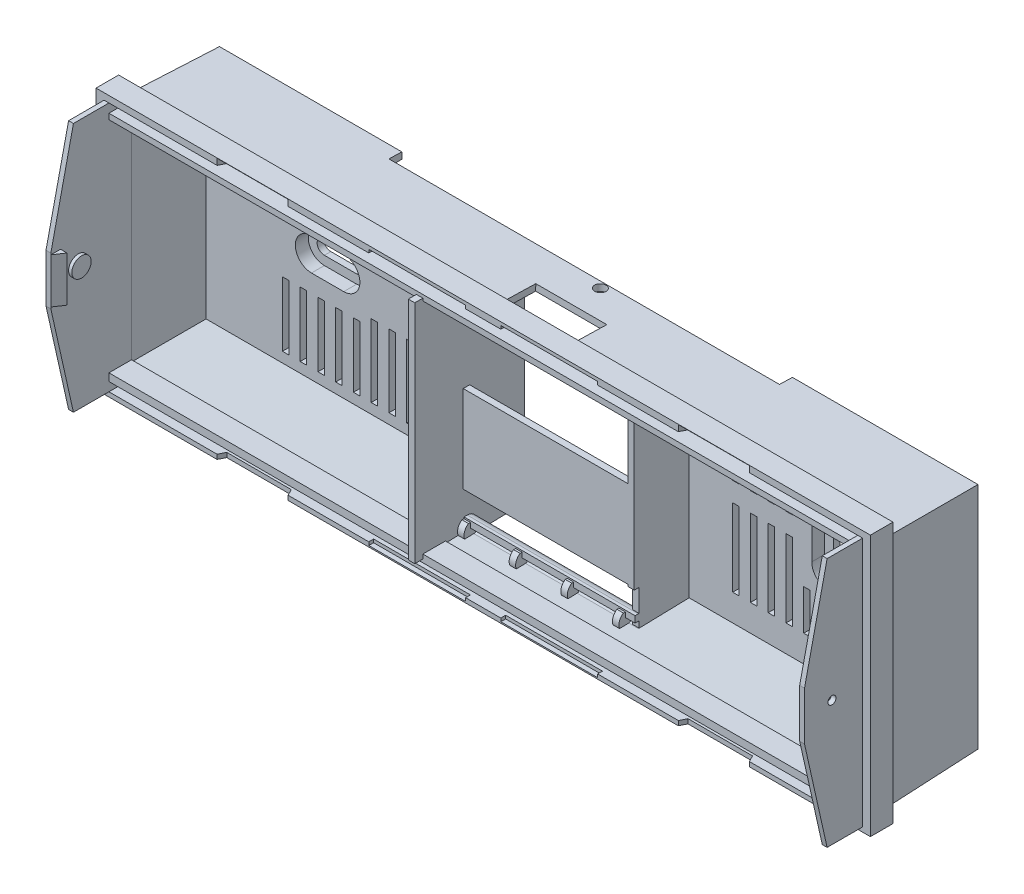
SolidWorks part; units mm, degrees
ref_plane "Plan1" through (0, 0, 0) normal (0, 0, 1) x (1, 0, 0)
ref_plane "Plan2" through (0, 0, 0) normal (0, 1, 0) x (1, 0, 0)
ref_plane "Plan3" through (0, 0, 0) normal (1, 0, 0) x (0, 0, -1)
sketch "Esquisse1" plane through (0, 0, 0) normal (0, 0, 1) x (1, 0, 0)
  line L1 (-124, 35.5) -> (111, 35.5)
  line L2 (-124, 35.5) -> (-124, -35.5)
  line L3 (-124, -35.5) -> (111, -35.5)
  line L4 (111, 35.5) -> (111, -35.5)
  dimension "D1" = 235
  dimension "D2" = 71
  dimension "D3" = 35.5
  dimension "D4" = 111
extrude "Extrusion1" add sketch "Esquisse1" along normal blind 1.5
sketch "Esquisse2" plane through (0, 0, 0) normal (0, 0, -1) x (-1, 0, 0)
  line L1 (-111, 35.5) -> (124, 35.5)
  line L2 (-111, 35.5) -> (-111, -35.5)
  line L3 (-111, -35.5) -> (124, -35.5)
  line L4 (124, 35.5) -> (124, -35.5)
extrude "Extrusion2" add sketch "Esquisse2" against normal blind 28.5 draft 1.5 from offset 4 contours L2 L3 L4 L1
sketch "Esquisse3" plane through (0, 0, 24.5) normal (0, 0, 1) x (1, 0, 0)
  line L0 (111.7463, 36.2463) -> (-124.7463, 36.2463) construction
  line L1 (-122.7463, 34.2463) -> (109.7463, 34.2463)
  line L2 (-122.7463, 34.2463) -> (-122.7463, -34.2463)
  line L3 (-122.7463, -34.2463) -> (109.7463, -34.2463)
  line L4 (109.7463, 34.2463) -> (109.7463, -34.2463)
  line L5 (-124.7463, 36.2463) -> (-124.7463, -36.2463) construction
  line L6 (111.7463, -36.2463) -> (-124.7463, -36.2463) construction
  line L7 (111.7463, 36.2463) -> (111.7463, -36.2463) construction
  dimension "D1" = 2
  dimension "D2" = 2
  dimension "D3" = 2
  dimension "D4" = 2
extrude "Enlèv. mat.-Extru.1" cut sketch "Esquisse3" against normal blind 22.5 draft 1.5
sketch "Esquisse4" plane through (0, 0, -4) normal (0, 0, -1) x (-1, 0, 0)
  line L0 (-111, 35.5) -> (124, 35.5) construction
  line L1 (-109, 33.5) -> (122, 33.5)
  line L2 (-109, 33.5) -> (-109, -33.5)
  line L3 (-109, -33.5) -> (122, -33.5)
  line L4 (122, 33.5) -> (122, -33.5)
  line L5 (-111, 35.5) -> (-111, -35.5) construction
  line L6 (-111, -35.5) -> (124, -35.5) construction
  line L7 (124, 35.5) -> (124, -35.5) construction
  dimension "D1" = 2
  dimension "D2" = 2
  dimension "D3" = 2
  dimension "D4" = 2
extrude "Enlèv. mat.-Extru.2" cut sketch "Esquisse4" against normal blind 4
sketch "Esquisse5" plane through (0, 0, 0) normal (0, 1, 0) x (1, 0, 0)
  line L1 (111, 4) -> (-124, 4) construction
  line L2 (-67.5, 4) -> (53.5, 4)
  line L3 (-67.5, 4) -> (-67.5, 0)
  line L4 (-67.5, 0) -> (53.5, 0)
  line L5 (53.5, 4) -> (53.5, 0)
  dimension "D1" = 4
  dimension "D2" = 121
  dimension "D3" = 67.5
extrude "Enlèv. mat.-Extru.3" cut sketch "Esquisse5" against normal mid plane 80
sketch "Esquisse6" plane through (0, 0, 0) normal (0, 0, -1) x (-1, 0, 0)
  line L0 (-111.7463, -36.2463) -> (124.7463, -36.2463) construction
  line L1 (-25.5, 33.6047) -> (25.5, 33.6047)
  line L2 (-25.5, 33.6047) -> (-25.5, -36.2463)
  line L3 (-25.5, -36.2463) -> (25.5, -36.2463)
  line L4 (25.5, 33.6047) -> (25.5, -36.2463)
  line L5 (-53.5, 35.6047) -> (67.5, 35.6047) construction
  dimension "D1" = 51
  dimension "D2" = 25.5
  dimension "D3" = 2
extrude "Enlèv. mat.-Extru.4" cut sketch "Esquisse6" against normal blind 17
sketch "Esquisse7" plane through (0, 35.5803, -0.9317) normal (0, 0.9997, -0.0262) x (-1, 0, 0)
  line L0 (-53.5, 0.932) -> (67.5, 0.932) construction
  line L2 (-11, 11.932) -> (11, 11.932)
  line L3 (-11, 11.932) -> (-11, 22.432)
  line L4 (-11, 22.432) -> (11, 22.432)
  line L5 (11, 11.932) -> (11, 22.432)
  circle A0 centre (0, 2.932) radius 1.75
  dimension "D1" = 3.5
  dimension "D2" = 2
  dimension "D3" = 10.5
  dimension "D4" = 22
  dimension "D5" = 11
  dimension "D6" = 11
extrude "Enlèv. mat.-Extru.5" cut sketch "Esquisse7" against normal blind 10
sketch "Esquisse8" plane through (0, 0, 0) normal (0, 0, -1) x (-1, 0, 0)
  line L0 (-25.5, 33.6047) -> (-25.5, -35.6047) construction
  line L1 (-111, 35.5) -> (-53.5, 35.5) construction
  line L2 (-78.5, 5) -> (-78.5, -5)
  line L3 (67.5, 35.5) -> (124, 35.5) construction
  line L4 (-62.5, 5) -> (-62.5, -5)
  line L5 (79.5, 8) -> (89.5, 8)
  line L6 (25.5, -35.6047) -> (25.5, 33.6047) construction
  line L7 (79.5, -8) -> (89.5, -8)
  arc A0 (-78.5, 5) -> (-62.5, 5) centre (-70.5, 5) cw
  arc A1 (-62.5, -5) -> (-78.5, -5) centre (-70.5, -5) cw
  arc A2 (79.5, 8) -> (79.5, -8) centre (79.5, 0) ccw
  arc A3 (89.5, 8) -> (89.5, -8) centre (89.5, 0) cw
  dimension "D7" = 8
  dimension "D8" = 8
  dimension "D1" = 16
  dimension "D2" = 10
  dimension "D3" = 10
  dimension "D4" = 10
  dimension "D5" = 53
  dimension "D6" = 30.5
  dimension "D9" = 10
  dimension "D10" = 10
  dimension "D11" = 10
  dimension "D12" = 16
  dimension "D13" = 35.5
  dimension "D14" = 64
extrude "Extrusion3" add sketch "Esquisse8" along normal blind 4
sketch "Esquisse9" plane through (81.6987, 0.3521, -4) normal (0, 0, -1) x (-1, 0, 0)
  line L2 (161.1987, 4.6479) -> (171.1987, 4.6479)
  line L4 (161.1987, -5.3521) -> (171.1987, -5.3521)
  line L8 (6.1987, 4.6479) -> (6.1987, -5.3521)
  line L9 (16.1987, 4.6479) -> (16.1987, -5.3521)
  arc A0 (19.1987, 4.6479) -> (3.1987, 4.6479) centre (11.1987, 4.6479) ccw construction
  arc A1 (3.1987, -5.3521) -> (19.1987, -5.3521) centre (11.1987, -5.3521) ccw construction
  arc A2 (171.1987, -8.3521) -> (171.1987, 7.6479) centre (171.1987, -0.3521) ccw construction
  arc A3 (161.1987, 7.6479) -> (161.1987, -8.3521) centre (161.1987, -0.3521) ccw construction
  arc A6 (16.1987, -5.3521) -> (6.1987, -5.3521) centre (11.1987, -5.3521) cw
  arc A7 (6.1987, 4.6479) -> (16.1987, 4.6479) centre (11.1987, 4.6479) cw
  arc A8 (171.1987, 4.6479) -> (171.1987, -5.3521) centre (171.1987, -0.3521) cw
  arc A9 (161.1987, 4.6479) -> (161.1987, -5.3521) centre (161.1987, -0.3521) ccw
  dimension "D7" = 10
  dimension "D8" = 5
  dimension "D2" = 5
  dimension "D5" = 5
  dimension "D1" = 5
  dimension "D3" = 10
  dimension "D4" = 10
  dimension "D6" = 10
  dimension "D9" = 10
  dimension "D10" = 10
extrude "Enlèv. mat.-Extru.6" cut sketch "Esquisse9" against normal blind 10 from offset 2
sketch "Esquisse10" plane through (0, 0, -4) normal (0, 0, -1) x (-1, 0, 0)
  line L2 (-72.75, 5) -> (-72.75, -5)
  line L3 (79.5, 2.25) -> (89.5, 2.25)
  line L4 (-68.25, 5) -> (-68.25, -5)
  line L6 (79.5, -2.25) -> (89.5, -2.25)
  arc A0 (-72.75, 5) -> (-68.25, 5) centre (-70.5, 5) cw
  arc A1 (-68.25, -5) -> (-72.75, -5) centre (-70.5, -5) cw
  arc A2 (-62.5, 5) -> (-78.5, 5) centre (-70.5, 5) ccw construction
  arc A3 (-78.5, -5) -> (-62.5, -5) centre (-70.5, -5) ccw construction
  arc A4 (79.5, 2.25) -> (79.5, -2.25) centre (79.5, 0) ccw
  arc A5 (89.5, 2.25) -> (89.5, -2.25) centre (89.5, 0) cw
  arc A6 (89.5, -8) -> (89.5, 8) centre (89.5, 0) ccw construction
  arc A7 (79.5, 8) -> (79.5, -8) centre (79.5, 0) ccw construction
  dimension "D2" = 2.25
  dimension "D3" = 4.5
  dimension "D5" = 10
  dimension "D1" = 4.5
  dimension "D4" = 10
  dimension "D6" = 10
extrude "Enlèv. mat.-Extru.7" cut sketch "Esquisse10" against normal blind 10
sketch "Esquisse11" plane through (0, 0, 2) normal (0, 0, 1) x (1, 0, 0)
  line L1 (25.5, 35) -> (27.5, 35)
  line L2 (25.5, 35) -> (25.5, -35)
  line L3 (25.5, -35) -> (27.5, -35)
  line L4 (27.5, 35) -> (27.5, -35)
  dimension "D1" = 2
  dimension "D2" = 70
  dimension "D3" = 35
  dimension "D4" = 25.5
extrude "Extrusion4" add sketch "Esquisse11" along normal blind 17
sketch "Esquisse12" plane through (0, 0, 2) normal (0, 0, 1) x (1, 0, 0)
  line L1 (-25.5, 35) -> (-27.5, 35)
  line L2 (-25.5, 35) -> (-25.5, -35)
  line L3 (-25.5, -35) -> (-27.5, -35)
  line L4 (-27.5, 35) -> (-27.5, -35)
  dimension "D1" = 2
  dimension "D2" = 70
  dimension "D3" = 35
  dimension "D4" = 25.5
extrude "Extrusion5" add sketch "Esquisse12" along normal blind 32
sketch "Esquisse13" plane through (25.5, 0, 0) normal (-1, 0, 0) x (0, 0, 1)
  line L1 (19, 4.5) -> (17, 4.5)
  line L2 (19, 4.5) -> (19, -22.5)
  line L3 (19, -22.5) -> (17, -22.5)
  line L4 (17, 4.5) -> (17, -22.5)
  line L6 (0, 0) -> (23.4559, 0) construction
  line L7 (19, 34.1023) -> (19, -34.1023) construction
  dimension "D1" = 2
  dimension "D2" = 27
  dimension "D3" = 4.5
extrude "Extrusion6" add sketch "Esquisse13" along normal up to next
sketch "Esquisse15" plane through (27.5, 0, 0) normal (1, 0, 0) x (0, 0, -1)
  line L0 (-19, -34.1023) -> (-19, 34.1023) construction
  line L1 (-17.5, -34.063) -> (-19, -34.1023)
  line L2 (-19, -34.1023) -> (-19, -23.1023)
  line L3 (-19, -23.1023) -> (-17.5, -23.1023)
  line L4 (-17.5, -34.063) -> (-17.5, -23.1023)
  line L7 (-19, -34.1023) -> (-2, -33.6571) construction
  point P11 (-13.9712, -36.3603)
  dimension "D1" = 11
  dimension "D2" = 1.5
extrude "Enlèv. mat.-Extru.8" cut sketch "Esquisse15" against normal blind 10
sketch "Esquisse14" plane through (-25.5, 0, 0) normal (1, 0, 0) x (0, 0, -1)
  line L0 (-24.5, -36.2463) -> (4, -35.5) construction
  line L1 (0, -35.6047) -> (0, 33.6047) construction
  line L2 (-17.75, -34.0695) -> (-17.75, -36.0695)
  line L3 (-17.75, -32.0695) -> (-18.75, -32.0695)
  line L4 (-18.75, -32.0695) -> (-18.75, -30.0695)
  line L5 (-18.75, -30.0695) -> (-17.75, -30.0695)
  arc A0 (-17.75, -36.0695) -> (-17.75, -30.0695) centre (-17.75, -33.0695) ccw
  arc A1 (-17.75, -34.0695) -> (-17.75, -32.0695) centre (-17.75, -33.0695) ccw
  dimension "D1" = 3
  dimension "D2" = 17.75
  dimension "D4" = 1
  dimension "D3" = 2
extrude "Extrusion7" add sketch "Esquisse14" along normal up to surface (53 mm away)
sketch "Esquisse16" plane through (-25.5, 0, 0) normal (1, 0, 0) x (0, 0, -1)
  line L0 (-20.3644, -34.5409) -> (-16.3644, -34.5409)
  line L1 (-16.3644, -34.5409) -> (-16.3644, -30.5409)
  line L2 (-16.3644, -30.5409) -> (-19.3644, -30.5409)
  arc A0 (-17.6977, -34.0682) -> (-17.75, -32.0695) centre (-17.75, -33.0695) ccw construction
  arc A2 (-19.3644, -30.5409) -> (-20.3644, -34.5409) centre (-17.75, -33.0695) ccw
  point P1 (-18.6119, -29.1773)
  point P7 (-19.9491, -35.2924)
  dimension "D1" = 3
  dimension "D2" = 4
  dimension "D3" = 4
  dimension "D4" = 1
extrude "Extrusion8" add sketch "Esquisse16" along normal blind 2
pattern_linear "Répétition linéaire1" count 4 spacing 16 along (1, 0, 0) of "Extrusion8"
sketch "Esquisse17" plane through (0, 0, 24.5) normal (0, 0, 1) x (1, 0, 0)
  line L1 (-122.7463, 34.2463) -> (109.1571, 34.2463)
  line L2 (-122.7463, 34.2463) -> (-122.7463, -33.6571)
  line L3 (-122.7463, -33.6571) -> (109.1571, -33.6571)
  line L4 (109.1571, 34.2463) -> (109.1571, -33.6571)
  line L5 (-126.7463, 40.7463) -> (113.1571, 40.7463)
  line L6 (-126.7463, 40.7463) -> (-126.7463, -40.1571)
  line L7 (-126.7463, -40.1571) -> (113.1571, -40.1571)
  line L8 (113.1571, 40.7463) -> (113.1571, -40.1571)
  dimension "D1" = 6.5
  dimension "D2" = 6.5
  dimension "D3" = 4
  dimension "D4" = 4
extrude "Extrusion9" add sketch "Esquisse17" along normal blind 7
sketch "Esquisse18" plane through (0, 0, 31.5) normal (0, 0, 1) x (1, 0, 0)
  line L0 (-122.7463, 34.2463) -> (-122.7463, -33.6571) construction
  line L1 (-122.7463, 35.9963) -> (109.1571, 35.9963)
  line L2 (-122.7463, 35.9963) -> (-122.7463, 38.7463)
  line L3 (-122.7463, 38.7463) -> (109.1571, 38.7463)
  line L4 (109.1571, 35.9963) -> (109.1571, 38.7463)
  line L5 (109.1571, -33.6571) -> (109.1571, 34.2463) construction
  line L6 (113.1571, 40.7463) -> (-126.7463, 40.7463) construction
  line L7 (0, 0) -> (-126.1043, 0) construction
  line L8 (109.1571, -35.9963) -> (109.1571, -38.7463)
  line L9 (-122.7463, -38.7463) -> (109.1571, -38.7463)
  line L10 (-122.7463, -35.9963) -> (-122.7463, -38.7463)
  line L11 (-122.7463, -35.9963) -> (109.1571, -35.9963)
  dimension "D1" = 2.75
  dimension "D2" = 2
extrude "Enlèv. mat.-Extru.9" cut sketch "Esquisse18" against normal blind 5
sketch "Esquisse19" plane through (0, -40.1571, 0) normal (0, -1, 0) x (1, 0, 0)
  line L0 (-126.7463, 31.5) -> (113.1571, 31.5) construction
  line L1 (-67.2463, 31.5) -> (-89.2463, 31.5)
  line L2 (-68.2463, 29.5) -> (-67.2463, 31.5)
  line L3 (-68.2463, 29.5) -> (-88.2463, 29.5)
  line L4 (-88.2463, 29.5) -> (-89.2463, 31.5)
  line L5 (113.1571, 31.5) -> (113.1571, 24.5) construction
  line L6 (74.6571, 29.5) -> (75.6571, 31.5)
  line L7 (54.6571, 29.5) -> (74.6571, 29.5)
  line L8 (54.6571, 29.5) -> (53.6571, 31.5)
  line L9 (53.6571, 31.5) -> (75.6571, 31.5)
  line L10 (-126.7463, 31.5) -> (-126.7463, 24.5) construction
  point P6 (113.1571, 28)
  point P13 (-126.7463, 28)
  dimension "D1" = 2
  dimension "D2" = 20
  dimension "D3" = 22
  dimension "D4" = 1
  dimension "D5" = 38.5
  dimension "D6" = 22
  dimension "D7" = 20
  dimension "D9" = 1
  dimension "D10" = 2
  dimension "D11" = 38.5
extrude "Enlèv. mat.-Extru.10" cut sketch "Esquisse19" against normal blind 2.5 and the other way blind 0.5
sketch "Esquisse20" plane through (0, 0, 31.5) normal (0, 0, 1) x (1, 0, 0)
  line L0 (-67.2463, -38.7463) -> (53.6571, -38.7463) construction
  line L1 (-42.2463, -38.7463) -> (-12.2463, -38.7463)
  line L2 (-42.2463, -38.7463) -> (-42.2463, -39.7463)
  line L3 (-42.2463, -39.7463) -> (-12.2463, -39.7463)
  line L4 (-12.2463, -38.7463) -> (-12.2463, -39.7463)
  line L5 (-67.2463, -38.7463) -> (-67.2463, -40.1571) construction
  line L6 (28.6571, -38.7463) -> (-1.3429, -38.7463)
  line L7 (28.6571, -38.7463) -> (28.6571, -39.7463)
  line L8 (28.6571, -39.7463) -> (-1.3429, -39.7463)
  line L9 (-1.3429, -38.7463) -> (-1.3429, -39.7463)
  point P10 (-67.2463, -39.4517)
  dimension "D1" = 1
  dimension "D2" = 30
  dimension "D3" = 25
  dimension "D4" = 1
  dimension "D5" = 30
  dimension "D6" = 25
extrude "Enlèv. mat.-Extru.11" cut sketch "Esquisse20" against normal blind 1.5
mirror "Symétrie1" about plane through (0, 0, 0) normal (0, 1, 0) of "Enlèv. mat.-Extru.10", "Enlèv. mat.-Extru.11"
sketch "Esquisse22" plane through (-122.7463, 0, 0) normal (1, 0, 0) x (0, 0, -1)
  line L0 (-31.5, -38.7463) -> (-42.5, -38.7463)
  line L1 (-42.5, -38.7463) -> (-49.5, -7.5013)
  line L2 (-49.5, -7.5013) -> (-49.5, 7.4987)
  line L3 (-49.5, 7.4987) -> (-42.5, 38.7463)
  line L4 (-42.5, 38.7463) -> (-31.5, 38.7463)
  line L6 (-31.5, 38.7463) -> (-31.5, -38.7463)
  line L10 (-26.5, -38.7463) -> (-31.5, -38.7463) construction
  line L11 (-26.5, 38.7463) -> (-31.5, 38.7463) construction
  dimension "D1" = 11
  dimension "D2" = 11
  dimension "D3" = 7
  dimension "D4" = 15
  dimension "D5" = 31.245
extrude "Extrusion11" add sketch "Esquisse22" against normal blind 1.5
sketch "Esquisse23" plane through (0, 0, 0) normal (0, 1, 0) x (1, 0, 0)
  line L0 (-122.7463, -49.5) -> (-120.7463, -46.5)
  line L1 (-120.7463, -46.5) -> (-122.7463, -46.5)
  line L2 (-122.7463, -42.5) -> (-122.7463, -49.5) construction
  line L3 (-122.7463, -46.5) -> (-122.7463, -49.5)
  dimension "D1" = 2
  dimension "D2" = 3
extrude "Extrusion12" add sketch "Esquisse23" along normal mid plane 14
sketch "Esquisse26" plane through (-124.2463, 0, 0) normal (-1, 0, 0) x (0, 0, 1)
  line L0 (50, 0) -> (-50, 0) construction
  line L1 (49.5, 7.4987) -> (49.5, -7.5013) construction
  circle A0 centre (41, 0) radius 1.25
  point P6 (49.5, -0.0013)
  dimension "D1" = 2.5
  dimension "D2" = 8.5
extrude "Enlèv. mat.-Extru.13" cut sketch "Esquisse26" against normal blind 4
sketch "Esquisse27" plane through (-122.7463, 0, 0) normal (1, 0, 0) x (0, 0, -1)
  circle A0 centre (-41, 0) radius 3
  dimension "D1" = 6
extrude "Extrusion14" add sketch "Esquisse27" along normal blind 1
ref_plane "Plan4" through (-6.7463, 0, 0) normal (-1, 0, 0) x (0, 0, 1)
mirror "Symétrie3" about plane through (-6.7463, 0, 0) normal (-1, 0, 0) of "Extrusion14", "Enlèv. mat.-Extru.13", "Extrusion12", "Extrusion11"
sketch "Esquisse28" plane through (0, 0, 0) normal (0, 0, -1) x (-1, 0, 0)
  line L0 (84.5, 8) -> (42.7823, 8) construction
  line L1 (89.5, 8) -> (79.5, 8) construction
  line L2 (25.5, -35.6047) -> (25.5, 33.6047) construction
  line L3 (52.5, 28) -> (54.5, 28)
  line L4 (52.5, 28) -> (52.5, 8)
  line L5 (52.5, 8) -> (54.5, 8)
  line L6 (54.5, 28) -> (54.5, 8)
  line L7 (58, 28) -> (58, 8)
  line L8 (60, 28) -> (60, 8)
  line L9 (58, 8) -> (60, 8)
  line L10 (58, 28) -> (60, 28)
  line L11 (63.5, 28) -> (63.5, 8)
  line L12 (65.5, 28) -> (65.5, 8)
  line L13 (63.5, 8) -> (65.5, 8)
  line L14 (63.5, 28) -> (65.5, 28)
  line L15 (69, 28) -> (69, 8)
  line L16 (71, 28) -> (71, 8)
  line L17 (69, 8) -> (71, 8)
  line L18 (69, 28) -> (71, 28)
  line L19 (74.5, 28) -> (74.5, 8)
  line L20 (76.5, 28) -> (76.5, 8)
  line L21 (74.5, 8) -> (76.5, 8)
  line L22 (74.5, 28) -> (76.5, 28)
  line L23 (80, 28) -> (80, 8)
  line L24 (82, 28) -> (82, 8)
  line L25 (80, 8) -> (82, 8)
  line L26 (80, 28) -> (82, 28)
  line L27 (85.5, 28) -> (85.5, 8)
  line L28 (87.5, 28) -> (87.5, 8)
  line L29 (85.5, 8) -> (87.5, 8)
  line L30 (85.5, 28) -> (87.5, 28)
  line L31 (91, 28) -> (91, 8)
  line L32 (93, 28) -> (93, 8)
  line L33 (91, 8) -> (93, 8)
  line L34 (91, 28) -> (93, 28)
  line L35 (96.5, 28) -> (96.5, 8)
  line L36 (98.5, 28) -> (98.5, 8)
  line L37 (96.5, 8) -> (98.5, 8)
  line L38 (96.5, 28) -> (98.5, 28)
  dimension "D1" = 2
  dimension "D2" = 20
  dimension "D3" = 27
extrude "Enlèv. mat.-Extru.14" cut sketch "Esquisse28" against normal through all
sketch "Esquisse29" plane through (0, 0, 0) normal (0, 0, -1) x (-1, 0, 0)
  line L0 (84.5, -8) -> (46.1883, -8) construction
  line L1 (79.5, -8) -> (89.5, -8) construction
  line L2 (25.5, -35.6047) -> (25.5, 33.6047) construction
  line L3 (52.5, -8) -> (54.5, -8)
  line L4 (52.5, -8) -> (52.5, -30.5)
  line L5 (52.5, -30.5) -> (54.5, -30.5)
  line L6 (54.5, -8) -> (54.5, -30.5)
  line L7 (58, -8) -> (58, -30.5)
  line L8 (58, -8) -> (60, -8)
  line L9 (60, -8) -> (60, -30.5)
  line L10 (58, -30.5) -> (60, -30.5)
  line L11 (63.5, -8) -> (63.5, -30.5)
  line L12 (63.5, -8) -> (65.5, -8)
  line L13 (65.5, -8) -> (65.5, -30.5)
  line L14 (63.5, -30.5) -> (65.5, -30.5)
  line L15 (69, -8) -> (69, -30.5)
  line L16 (69, -8) -> (71, -8)
  line L17 (71, -8) -> (71, -30.5)
  line L18 (69, -30.5) -> (71, -30.5)
  dimension "D1" = 2
  dimension "D2" = 22.5
  dimension "D3" = 27
extrude "Enlèv. mat.-Extru.15" cut sketch "Esquisse29" against normal through all
sketch "Esquisse30" plane through (0, 0, 0) normal (0, 0, -1) x (-1, 0, 0)
  line L0 (71, -30.5) -> (71, -8) construction
  line L1 (74.5, -10.5) -> (76.5, -10.5)
  line L2 (74.5, -10.5) -> (74.5, -30.5)
  line L3 (74.5, -30.5) -> (76.5, -30.5)
  line L4 (76.5, -10.5) -> (76.5, -30.5)
  line L5 (71, -8) -> (69, -8) construction
  line L6 (80, -10.5) -> (82, -10.5)
  line L7 (80, -10.5) -> (80, -30.5)
  line L8 (82, -10.5) -> (82, -30.5)
  line L9 (80, -30.5) -> (82, -30.5)
  line L10 (85.5, -10.5) -> (87.5, -10.5)
  line L11 (85.5, -10.5) -> (85.5, -30.5)
  line L12 (87.5, -10.5) -> (87.5, -30.5)
  line L13 (85.5, -30.5) -> (87.5, -30.5)
  line L14 (91, -10.5) -> (93, -10.5)
  line L15 (91, -10.5) -> (91, -30.5)
  line L16 (93, -10.5) -> (93, -30.5)
  line L17 (91, -30.5) -> (93, -30.5)
  line L18 (96.5, -10.5) -> (98.5, -10.5)
  line L19 (96.5, -10.5) -> (96.5, -30.5)
  line L20 (98.5, -10.5) -> (98.5, -30.5)
  line L21 (96.5, -30.5) -> (98.5, -30.5)
  dimension "D1" = 2
  dimension "D2" = 20
  dimension "D3" = 3.5
  dimension "D4" = 2.5
extrude "Enlèv. mat.-Extru.16" cut sketch "Esquisse30" against normal through all
sketch "Esquisse31" plane through (0, 0, 0) normal (0, 0, -1) x (-1, 0, 0)
  line L0 (-25.5, 33.6047) -> (-25.5, -35.6047) construction
  line L1 (-43, 28.6047) -> (-41, 28.6047)
  line L2 (-43, 28.6047) -> (-43, 4.6047)
  line L3 (-43, 4.6047) -> (-41, 4.6047)
  line L4 (-41, 28.6047) -> (-41, 4.6047)
  line L5 (-53.5, 35.6047) -> (67.5, 35.6047) construction
  line L6 (-48.5, 28.6047) -> (-48.5, 4.6047)
  line L7 (-48.5, 28.6047) -> (-46.5, 28.6047)
  line L8 (-46.5, 28.6047) -> (-46.5, 4.6047)
  line L9 (-48.5, 4.6047) -> (-46.5, 4.6047)
  line L10 (-54, 28.6047) -> (-54, 4.6047)
  line L11 (-54, 28.6047) -> (-52, 28.6047)
  line L12 (-52, 28.6047) -> (-52, 4.6047)
  line L13 (-54, 4.6047) -> (-52, 4.6047)
  line L14 (-59.5, 28.6047) -> (-59.5, 4.6047)
  line L15 (-59.5, 28.6047) -> (-57.5, 28.6047)
  line L16 (-57.5, 28.6047) -> (-57.5, 4.6047)
  line L17 (-59.5, 4.6047) -> (-57.5, 4.6047)
  dimension "D1" = 2
  dimension "D2" = 24
  dimension "D3" = 15.5
  dimension "D4" = 7
extrude "Enlèv. mat.-Extru.17" cut sketch "Esquisse31" against normal through all
sketch "Esquisse32" plane through (0, 0, 0) normal (0, 0, -1) x (-1, 0, 0)
  line L0 (-43, 4.6047) -> (-41, 4.6047) construction
  line L1 (-43, -1.3953) -> (-41, -1.3953)
  line L2 (-43, -1.3953) -> (-43, -25.3953)
  line L3 (-43, -25.3953) -> (-41, -25.3953)
  line L4 (-41, -1.3953) -> (-41, -25.3953)
  line L5 (-25.5, 33.6047) -> (-25.5, -35.6047) construction
  line L6 (-48.5, -1.3953) -> (-48.5, -25.3953)
  line L7 (-48.5, -1.3953) -> (-46.5, -1.3953)
  line L8 (-46.5, -1.3953) -> (-46.5, -25.3953)
  line L9 (-48.5, -25.3953) -> (-46.5, -25.3953)
  line L10 (-54, -1.3953) -> (-54, -25.3953)
  line L11 (-54, -1.3953) -> (-52, -1.3953)
  line L12 (-52, -1.3953) -> (-52, -25.3953)
  line L13 (-54, -25.3953) -> (-52, -25.3953)
  line L14 (-59.5, -1.3953) -> (-59.5, -25.3953)
  line L15 (-59.5, -1.3953) -> (-57.5, -1.3953)
  line L16 (-57.5, -1.3953) -> (-57.5, -25.3953)
  line L17 (-59.5, -25.3953) -> (-57.5, -25.3953)
  dimension "D1" = 2
  dimension "D2" = 24
  dimension "D3" = 6
  dimension "D4" = 15.5
extrude "Enlèv. mat.-Extru.18" cut sketch "Esquisse32" against normal through all
sketch "Esquisse33" plane through (0, 0, 0) normal (0, 0, -1) x (-1, 0, 0)
  line L0 (-59.5, 28.6047) -> (-59.5, 4.6047) construction
  line L1 (-65, 28.6047) -> (-63, 28.6047)
  line L2 (-65, 28.6047) -> (-65, 13.6047)
  line L3 (-65, 13.6047) -> (-63, 13.6047)
  line L4 (-63, 28.6047) -> (-63, 13.6047)
  line L5 (-53.5, 35.6047) -> (67.5, 35.6047) construction
  line L6 (-70.5, 28.6047) -> (-70.5, 13.6047)
  line L7 (-70.5, 28.6047) -> (-68.5, 28.6047)
  line L8 (-68.5, 28.6047) -> (-68.5, 13.6047)
  line L9 (-70.5, 13.6047) -> (-68.5, 13.6047)
  line L10 (-76, 28.6047) -> (-76, 13.6047)
  line L11 (-76, 28.6047) -> (-74, 28.6047)
  line L12 (-74, 28.6047) -> (-74, 13.6047)
  line L13 (-76, 13.6047) -> (-74, 13.6047)
  line L14 (-81.5, 28.6047) -> (-81.5, 13.6047)
  line L15 (-81.5, 28.6047) -> (-79.5, 28.6047)
  line L16 (-79.5, 28.6047) -> (-79.5, 13.6047)
  line L17 (-81.5, 13.6047) -> (-79.5, 13.6047)
  point P4 (-59.5, 16.6047)
  dimension "D1" = 2
  dimension "D2" = 3.5
  dimension "D3" = 15
  dimension "D4" = 7
extrude "Enlèv. mat.-Extru.19" cut sketch "Esquisse33" against normal through all
sketch "Esquisse34" plane through (0, 0, 0) normal (0, 0, -1) x (-1, 0, 0)
  line L0 (-53.5, 35.6047) -> (67.5, 35.6047) construction
  line L1 (-87, 28.6047) -> (-85, 28.6047)
  line L2 (-87, 28.6047) -> (-87, 4.6047)
  line L3 (-87, 4.6047) -> (-85, 4.6047)
  line L4 (-85, 28.6047) -> (-85, 4.6047)
  line L5 (-81.5, 28.6047) -> (-81.5, 13.6047) construction
  dimension "D1" = 2
  dimension "D2" = 24
  dimension "D3" = 7
  dimension "D4" = 3.5
extrude "Enlèv. mat.-Extru.20" cut sketch "Esquisse34" against normal through all
sketch "Esquisse35" plane through (0, 0, 0) normal (0, 0, -1) x (-1, 0, 0)
  line L0 (-58.5, -25.3953) -> (-93.0899, -25.3953) construction
  line L1 (-59.5, -25.3953) -> (-57.5, -25.3953) construction
  line L2 (-59.5, -1.3953) -> (-59.5, -25.3953) construction
  line L3 (-63, -25.3953) -> (-65, -25.3953)
  line L4 (-63, -25.3953) -> (-63, -12.8953)
  line L5 (-63, -12.8953) -> (-65, -12.8953)
  line L6 (-65, -25.3953) -> (-65, -12.8953)
  line L7 (-81.5, -25.3953) -> (-81.5, -12.8953)
  line L8 (-79.5, -12.8953) -> (-81.5, -12.8953)
  line L9 (-79.5, -25.3953) -> (-79.5, -12.8953)
  line L10 (-79.5, -25.3953) -> (-81.5, -25.3953)
  dimension "D1" = 3.5
  dimension "D2" = 2
  dimension "D3" = 12.5
extrude "Enlèv. mat.-Extru.21" cut sketch "Esquisse35" against normal through all
sketch "Esquisse36" plane through (0, 0, 0) normal (0, 0, -1) x (-1, 0, 0)
  line L0 (-53.5, -35.6047) -> (-25.5, -35.6047) construction
  line L1 (-68.5, -25.3953) -> (-70.5, -25.3953)
  line L2 (-68.5, -25.3953) -> (-68.5, -15.3953)
  line L3 (-68.5, -15.3953) -> (-70.5, -15.3953)
  line L4 (-70.5, -25.3953) -> (-70.5, -15.3953)
  line L5 (-65, -12.8953) -> (-65, -25.3953) construction
  line L6 (-74, -15.3953) -> (-76, -15.3953)
  line L7 (-76, -25.3953) -> (-76, -15.3953)
  line L8 (-74, -25.3953) -> (-76, -25.3953)
  line L9 (-74, -25.3953) -> (-74, -15.3953)
  dimension "D1" = 10.2095
  dimension "D2" = 10
  dimension "D3" = 3.5
  dimension "D4" = 2
extrude "Enlèv. mat.-Extru.22" cut sketch "Esquisse36" against normal through all
sketch "Esquisse37" plane through (0, 0, 0) normal (0, 0, -1) x (-1, 0, 0)
  line L0 (-53.5, -35.6047) -> (-25.5, -35.6047) construction
  line L1 (-87, -25.3953) -> (-85, -25.3953)
  line L2 (-87, -25.3953) -> (-87, -1.3953)
  line L3 (-87, -1.3953) -> (-85, -1.3953)
  line L4 (-85, -25.3953) -> (-85, -1.3953)
  line L5 (-81.5, -12.8953) -> (-81.5, -25.3953) construction
  dimension "D1" = 10.2095
  dimension "D2" = 3.5
  dimension "D3" = 2
  dimension "D4" = 24
extrude "Enlèv. mat.-Extru.23" cut sketch "Esquisse37" against normal through all
